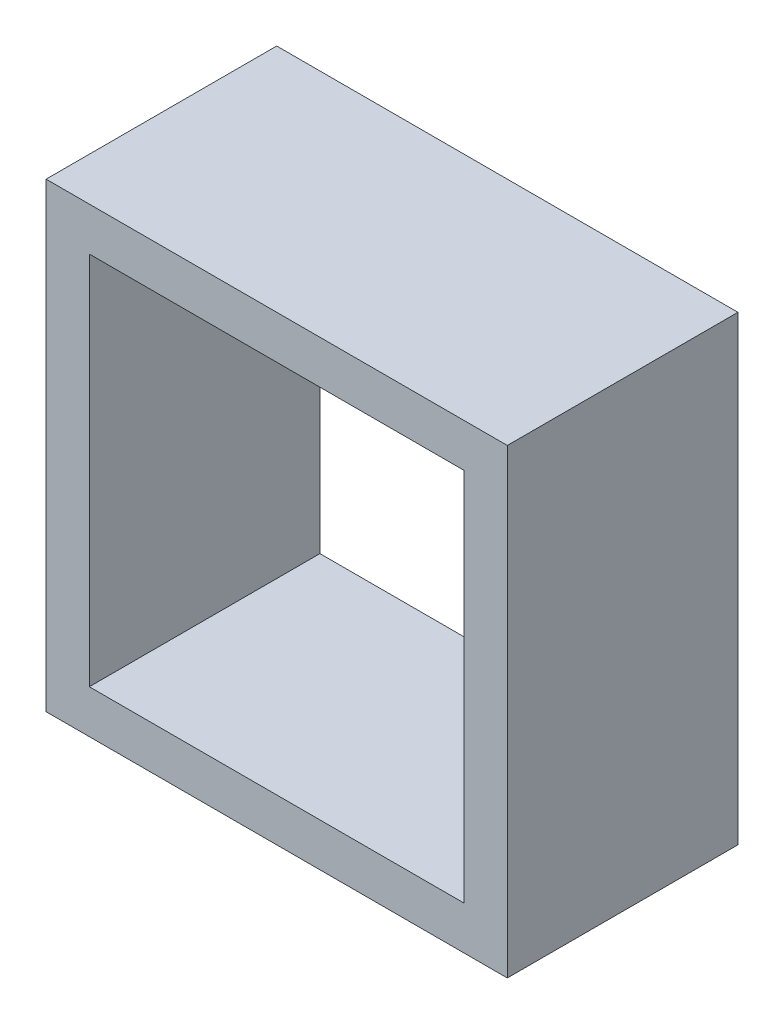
SolidWorks part; units mm, degrees
ref_plane "Plane1" through (0, 0, 0) normal (0, 0, 1) x (1, 0, 0)
ref_plane "Plane2" through (0, 0, 0) normal (0, 1, 0) x (1, 0, 0)
ref_plane "Plane3" through (0, 0, 0) normal (1, 0, 0) x (0, 0, -1)
other "Configuration Table"
sketch "Sketch1" plane through (0, 0, 0) normal (0, 0, 1) x (1, 0, 0)
  line L0 (4.7625, 4.7625) -> (4.7625, 46.0375)
  line L1 (46.0375, 46.0375) -> (4.7625, 46.0375)
  line L2 (46.0375, 46.0375) -> (46.0375, 4.7625)
  line L3 (4.7625, 4.7625) -> (46.0375, 4.7625)
  line L4 (0, 0) -> (50.8, 0)
  line L5 (0, 0) -> (0, 50.8)
  line L6 (50.8, 50.8) -> (0, 50.8)
  line L7 (50.8, 50.8) -> (50.8, 0)
extrude "BaseTube" add sketch "Sketch1" along normal mid plane 25.4
